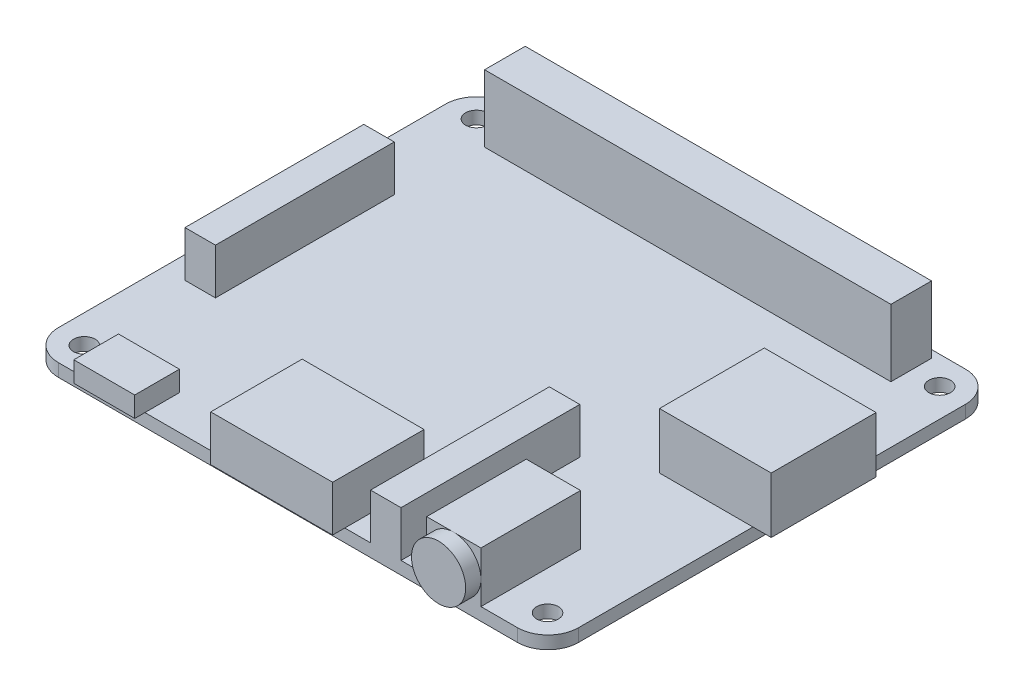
SolidWorks part; units mm, degrees
ref_plane "Front Plane" through (0, 0, 0) normal (0, 0, 1) x (1, 0, 0)
ref_plane "Top Plane" through (0, 0, 0) normal (0, 1, 0) x (1, 0, 0)
ref_plane "Right Plane" through (0, 0, 0) normal (1, 0, 0) x (0, 0, -1)
sketch "Sketch1" plane through (0, 0, 0) normal (0, 1, 0) x (1, 0, 0)
  line L1 (32.5, -28) -> (-32.5, -28)
  line L2 (32.5, -28) -> (32.5, 28)
  line L3 (32.5, 28) -> (-32.5, 28)
  line L4 (-32.5, -28) -> (-32.5, 28)
  line L5 (32.5, -28) -> (-32.5, 28) construction
  line L6 (32.5, 28) -> (-32.5, -28) construction
  point P0 (0, 0)
  dimension "D1" = 56
  dimension "D2" = 65
extrude "Boss-Extrude1" add sketch "Sketch1" along normal blind 1.6002
fillet "Fillet1" radius 3.81 4 edges at (-32.5, 0.8001, -28) (32.5, 0.8001, -28) (-32.5, 0.8001, 28) (32.5, 0.8001, 28)
hole_wizard "#2 Clearance Hole1" positions "Sketch3" profile "Sketch4" hole size "#2" standard "ANSI Inch"
sketch "Sketch3" plane through (0, 1.6002, 0) normal (0, 1, 0) x (1, 0, 0)
  line L7 (0, 0) -> (0, 28) construction
  line L8 (28.69, 28) -> (-28.69, 28) construction
  line L10 (0, 0) -> (32.5, 0) construction
  line L11 (32.5, -24.19) -> (32.5, 24.19) construction
  point P186 (-28.956, 24.511)
  point P188 (-28.956, -24.511)
  point P190 (28.956, -24.511)
  point P192 (28.956, 24.511)
  dimension "D1" = 49.022
  dimension "D2" = 57.912
sketch "Sketch4" plane through (-28.956, 1.6002, -24.511) normal (1, 0, 0) x (0, 0, 1)
  line L0 (0, 0) -> (0, 8.4327)
  line L1 (0, 8.4327) -> (1.3525, 7.62)
  line L2 (1.3525, 7.62) -> (1.3525, 0)
  line L5 (1.3525, 0) -> (0, 0)
  line L10 (0, 8.4327) -> (-1.3526, 7.62) construction
  line L11 (0, -6.35) -> (0, 107.95) construction
  dimension "Hole Dia." = 2.7051
  dimension "Hole Depth" = 7.62
  dimension "Drill Angle" = 118
sketch "Sketch5" plane through (0, 1.6002, 0) normal (0, 1, 0) x (1, 0, 0)
  line L0 (28.69, 28) -> (-28.69, 28) construction
  line L1 (20.816, 10.728) -> (34.786, 10.728)
  line L2 (20.816, 10.728) -> (20.816, -2.3784)
  line L3 (20.816, -2.3784) -> (34.786, -2.3784)
  line L4 (34.786, 10.728) -> (34.786, -2.3784)
  line L5 (20.816, 10.728) -> (34.786, -2.3784) construction
  line L6 (20.816, -2.3784) -> (34.786, 10.728) construction
  line L7 (32.5, -24.19) -> (32.5, 24.19) construction
  point P0 (27.801, 4.1748)
  dimension "D1" = 17.272
  dimension "D2" = 13.97
  dimension "D3" = 13.1064
  dimension "D4" = 2.286
extrude "Boss-Extrude2" add sketch "Sketch5" along normal blind 6.985
sketch "Sketch6" plane through (0, 1.6002, 0) normal (0, 1, 0) x (1, 0, 0)
  line L1 (-25.4, 27.051) -> (25.4, 27.051)
  line L2 (-25.4, 27.051) -> (-25.4, 21.971)
  line L3 (-25.4, 21.971) -> (25.4, 21.971)
  line L4 (25.4, 27.051) -> (25.4, 21.971)
  line L5 (-25.4, 27.051) -> (25.4, 21.971) construction
  line L6 (-25.4, 21.971) -> (25.4, 27.051) construction
  point P0 (0, 24.511)
  point P5 (-28.956, 24.511)
  dimension "D1" = 5.08
  dimension "D2" = 50.8
extrude "Boss-Extrude3" add sketch "Sketch6" along normal blind 8.382
sketch "Sketch7" plane through (0, 1.6002, 0) normal (0, 1, 0) x (1, 0, 0)
  line L0 (-32.5, 24.19) -> (-32.5, -24.19) construction
  line L1 (-29.706, 11.176) -> (-25.896, 11.176)
  line L2 (-29.706, 11.176) -> (-29.706, -11.176)
  line L3 (-29.706, -11.176) -> (-25.896, -11.176)
  line L4 (-25.896, 11.176) -> (-25.896, -11.176)
  line L5 (-29.706, 11.176) -> (-25.896, -11.176) construction
  line L6 (-29.706, -11.176) -> (-25.896, 11.176) construction
  point P0 (-27.801, 0)
  dimension "D1" = 22.352
  dimension "D2" = 3.81
  dimension "D3" = 2.794
extrude "Boss-Extrude4" add sketch "Sketch7" along normal blind 5.715
sketch "Sketch8" plane through (0, 1.6002, 0) normal (0, 1, 0) x (1, 0, 0)
  line L0 (32.5, -24.19) -> (32.5, -2.3784) construction
  line L1 (-8.14, -18.094) -> (7.1, -18.094)
  line L2 (-8.14, -18.094) -> (-8.14, -29.524)
  line L3 (-8.14, -29.524) -> (7.1, -29.524)
  line L4 (7.1, -18.094) -> (7.1, -29.524)
  line L5 (-8.14, -18.094) -> (7.1, -29.524) construction
  line L6 (-8.14, -29.524) -> (7.1, -18.094) construction
  line L7 (-28.69, -28) -> (28.69, -28) construction
  point P0 (-0.52, -23.809)
  dimension "D1" = 15.24
  dimension "D2" = 25.4
  dimension "D3" = 11.43
  dimension "D4" = 1.524
extrude "Boss-Extrude5" add sketch "Sketch8" along normal blind 5.715
sketch "Sketch9" plane through (0, 1.6002, 0) normal (0, 1, 0) x (1, 0, 0)
  line L0 (7.1, -28) -> (28.69, -28) construction
  line L1 (17.3362, -15.554) -> (24.118, -15.554)
  line L2 (17.3362, -15.554) -> (17.3362, -28)
  line L3 (17.3362, -28) -> (24.118, -28)
  line L4 (24.118, -15.554) -> (24.118, -28)
  line L5 (17.3362, -15.554) -> (24.118, -28) construction
  line L6 (17.3362, -28) -> (24.118, -15.554) construction
  line L7 (32.5, -24.19) -> (32.5, -2.3784) construction
  point P0 (20.7271, -21.777)
  dimension "D1" = 6.7818
  dimension "D2" = 12.446
  dimension "D3" = 8.382
extrude "Boss-Extrude6" add sketch "Sketch9" along normal blind 6.35
sketch "Sketch10" plane through (0, 0, 28) normal (0, 0, 1) x (1, 0, 0)
  line L0 (17.3362, 7.9502) -> (17.3362, 1.6002) construction
  line L1 (17.3362, 7.9502) -> (24.118, 7.9502) construction
  line L2 (24.118, 7.9502) -> (24.118, 1.6002) construction
  circle A0 centre (20.7271, 4.5593) radius 3.3909
extrude "Boss-Extrude7" add sketch "Sketch10" along normal blind 1.905
sketch "Sketch11" plane through (0, 1.6002, 0) normal (0, 1, 0) x (1, 0, 0)
  line L0 (-25.896, -11.176) -> (-25.896, 11.176) construction
  line L1 (10.3131, -5.648) -> (14.1231, -5.648)
  line L2 (10.3131, -5.648) -> (10.3131, -28)
  line L3 (10.3131, -28) -> (14.1231, -28)
  line L4 (14.1231, -5.648) -> (14.1231, -28)
  line L5 (10.3131, -5.648) -> (14.1231, -28) construction
  line L6 (10.3131, -28) -> (14.1231, -5.648) construction
  line L7 (-25.896, 11.176) -> (-29.706, 11.176) construction
  line L9 (7.1, -28) -> (17.3362, -28) construction
  line L10 (7.1, -18.094) -> (17.3362, -18.094) construction
  line L11 (17.3362, -15.554) -> (17.3362, -28) construction
  point P0 (12.2181, -16.824)
  point P16 (12.2181, -18.094)
extrude "Boss-Extrude8" add sketch "Sketch11" along normal up to surface (5.715 mm away)
sketch "Sketch12" plane through (0, 1.6002, 0) normal (0, 1, 0) x (1, 0, 0)
  line L0 (-28.69, -28) -> (-8.14, -28) construction
  line L1 (-25.515, -23.682) -> (-17.895, -23.682)
  line L2 (-25.515, -23.682) -> (-25.515, -29.27)
  line L3 (-25.515, -29.27) -> (-17.895, -29.27)
  line L4 (-17.895, -23.682) -> (-17.895, -29.27)
  line L5 (-32.5, 24.19) -> (-32.5, -24.19) construction
  dimension "D1" = 7.62
  dimension "D2" = 5.588
  dimension "D3" = 1.27
  dimension "D4" = 6.985
extrude "Boss-Extrude9" add sketch "Sketch12" along normal blind 2.54
sketch "Sketch13" plane through (0, 0, 0) normal (0, -1, 0) x (1, 0, 0)
  line L0 (-28.69, 28) -> (28.69, 28) construction
  line L1 (-32.5, 6.41) -> (-18.53, 6.41)
  line L2 (-32.5, 6.41) -> (-32.5, -6.671)
  line L3 (-32.5, -6.671) -> (-18.53, -6.671)
  line L4 (-18.53, 6.41) -> (-18.53, -6.671)
  line L5 (-32.5, 6.41) -> (-18.53, -6.671) construction
  line L6 (-32.5, -6.671) -> (-18.53, 6.41) construction
  line L7 (-32.5, -24.19) -> (-32.5, 24.19) construction
  point P0 (-25.515, -0.1305)
  dimension "D1" = 21.59
  dimension "D2" = 13.97
  dimension "D3" = 13.081
extrude "Boss-Extrude10" add sketch "Sketch13" along normal blind 1.27
